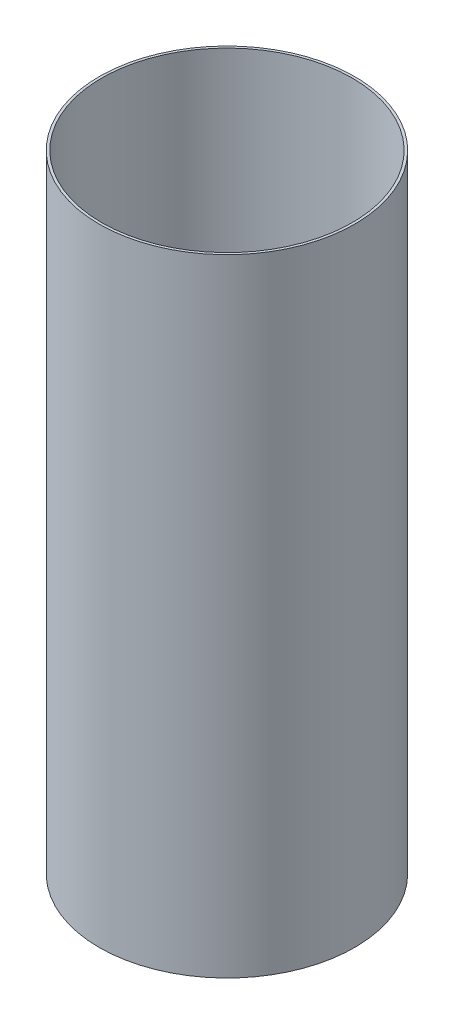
SolidWorks part; units mm, degrees
ref_plane "Front Plane" through (0, 0, 0) normal (0, 0, 1) x (1, 0, 0)
ref_plane "Top Plane" through (0, 0, 0) normal (0, 1, 0) x (1, 0, 0)
ref_plane "Right Plane" through (0, 0, 0) normal (1, 0, 0) x (0, 0, -1)
sketch "Sketch1" plane through (0, 0, 0) normal (0, 1, 0) x (1, 0, 0)
  circle A0 centre (0, 0) radius 1.2954
  circle A1 centre (0, 0) radius 1.27
  dimension "D1" = 2.54
  dimension "D2" = 0.0254
extrude "Boss-Extrude1" add sketch "Sketch1" along normal blind 6.35
